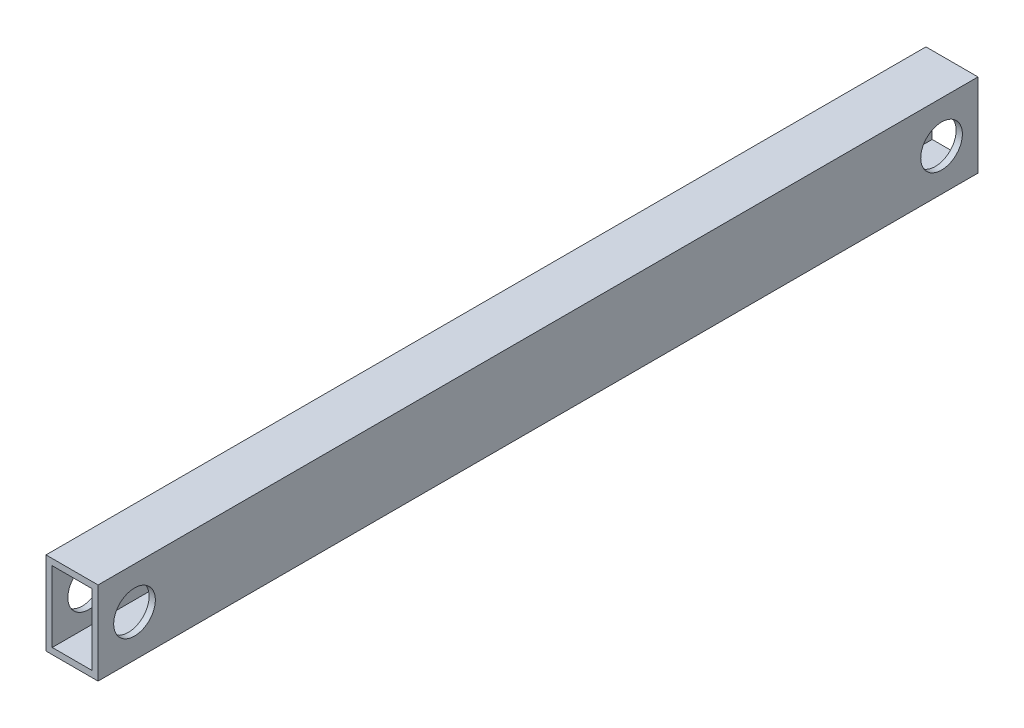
SolidWorks part; units mm, degrees
ref_plane "Plan de face" through (0, 0, 0) normal (0, 0, 1) x (1, 0, 0)
ref_plane "Plan de dessus" through (0, 0, 0) normal (0, 1, 0) x (1, 0, 0)
ref_plane "Plan de droite" through (0, 0, 0) normal (1, 0, 0) x (0, 0, -1)
sketch "Esquisse1" plane through (0, 0, 0) normal (0, 0, 1) x (1, 0, 0)
  line L1 (0, 0) -> (50, 0)
  line L2 (0, 0) -> (0, -80)
  line L3 (0, -80) -> (50, -80)
  line L4 (50, 0) -> (50, -80)
  dimension "D1" = 50
  dimension "D2" = 80
extrude "Extru.-Mince1" add sketch "Esquisse1" along normal blind 845 thin
sketch "Esquisse2" plane through (50, 0, 0) normal (1, 0, 0) x (0, 0, -1)
  line L0 (0, -80) -> (0, 0) construction
  line L1 (-845, -80) -> (-845, 0) construction
  circle A0 centre (-810, -40) radius 20
  circle A1 centre (-35, -40) radius 20
  point P4 (0, -40)
  dimension "D1" = 40
  dimension "D4" = 40
  dimension "D2" = 35
  dimension "D3" = 35
extrude "Enlèv. mat.-Extru.1" cut sketch "Esquisse2" against normal through all
